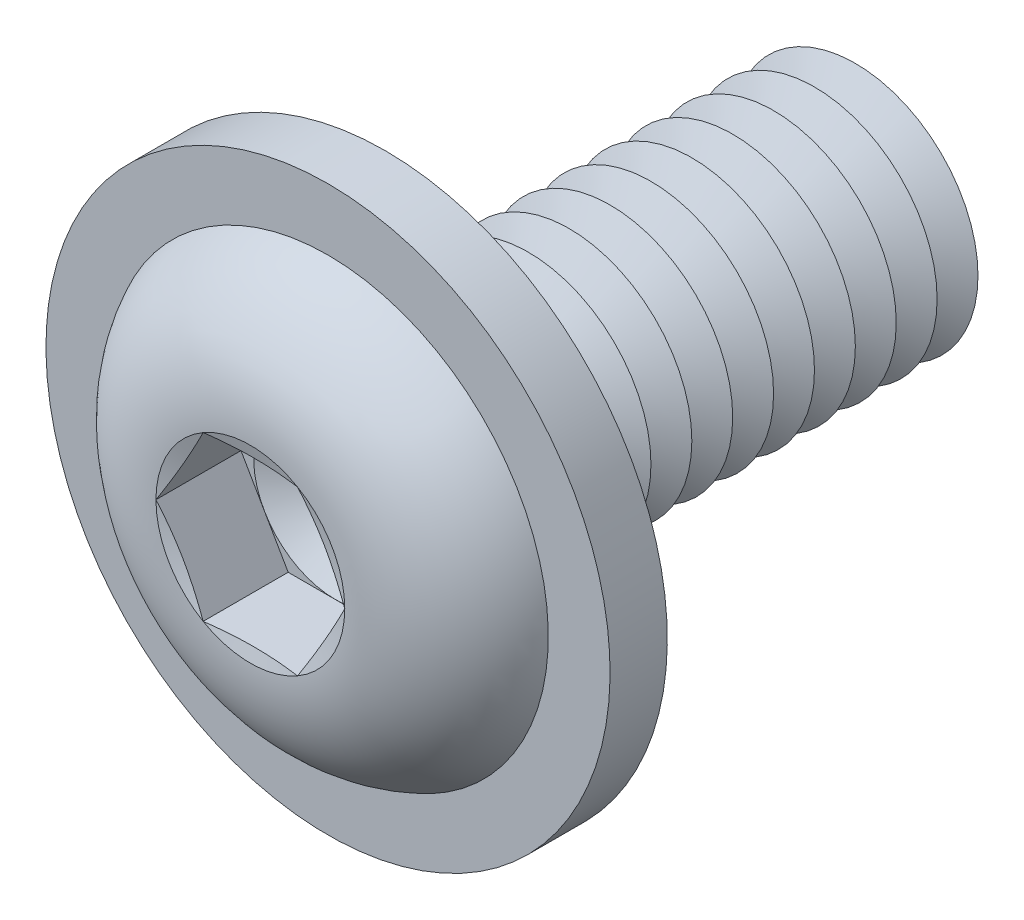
SolidWorks part; units mm, degrees
ref_plane "Front Plane" through (0, 0, 0) normal (0, 0, 1) x (1, 0, 0)
ref_plane "Top Plane" through (0, 0, 0) normal (0, 1, 0) x (1, 0, 0)
ref_plane "Right Plane" through (0, 0, 0) normal (1, 0, 0) x (0, 0, -1)
sketch "Sketch1" plane through (0, 0, 0) normal (1, 0, 0) x (0, 0, -1)
  line L0 (0, 1.5) -> (0, 2.85)
  line L3 (0, 1.5) -> (6, 1.5)
  line L4 (6, 1.5) -> (6, 0)
  line L5 (6, 0) -> (-1.65, 0) construction
  line L6 (-1.65, 0) -> (6, 0)
  line L7 (-1.65, 1.1547) -> (-1.65, 0.5773) construction
  line L8 (-1.65, 0.5773) -> (-1.65, 0)
  line L9 (-1.65, 1.1547) -> (-1.4953, 0.5773)
  line L10 (-1.4953, 0.5773) -> (-1.65, 0.5773)
  line L11 (6, 0) -> (22.7481, 0) construction
  line L12 (0, 2.85) -> (-1.65, 2.85) construction
  arc A1 (0, 2.85) -> (-1.65, 1.1547) centre (0, 1.1994) ccw
  point P8 (6, 0.75)
  dimension "D1" = 5.7
  dimension "D2" = 3
  dimension "D3" = 1.65
  dimension "D4" = 2.3094
  dimension "D5" = 6
  dimension "D6" = 15
revolve "Revolve1" add sketch "Sketch1" angle 360 about L5
fillet "Fillet1" radius 0.25 1 edges at (-1.5, 0, 0)
sketch "Sketch2" plane through (0, 0, 0) normal (1, 0, 0) x (0, 0, -1)
  line L0 (5.75, 1.5) -> (6.25, 1.5)
  line L1 (6, 1.5) -> (0.25, 1.5) construction
  line L2 (6.25, 1.5) -> (6, 1.067)
  line L3 (6, -1.5) -> (6, 1.5) construction
  line L4 (6, 1.067) -> (5.75, 1.5)
  dimension "D1" = 0.5
revolve "Cut-Revolve1" cut sketch "Sketch2" angle 360 about axis through (0, 0, -6) along (0, 0, -1)
pattern_linear "LPattern1" count 12 spacing 0.5 along (0, 0, 1) of "Cut-Revolve1"
sketch "Sketch3" plane through (0, 0, 1.65) normal (0, 0, 1) x (1, 0, 0)
  line L7 (0.5773, 1) -> (-0.5774, 1)
  line L8 (-0.5774, 1) -> (-1.1547, 0)
  line L9 (-1.1547, 0) -> (-0.5773, -1)
  line L10 (-0.5773, -1) -> (0.5773, -1)
  line L11 (0.5773, -1) -> (1.1547, 0)
  line L12 (1.1547, 0) -> (0.5773, 1)
  circle A0 centre (0, 0) radius 1 construction
  circle A3 centre (0, 0) radius 1.1547 construction
extrude "Cut-Extrude1" cut sketch "Sketch3" against normal blind 1.04
sketch "Sketch4" plane through (0, 0, 0.61) normal (0, 0, 1) x (1, 0, 0)
  line L1 (0.5773, 1) -> (-0.5774, 1) construction
  circle A0 centre (0, 0) radius 1
extrude "Cut-Extrude2" cut sketch "Sketch4" against normal through all draft 60
sketch "Sketch5" plane through (0, 0, 0) normal (0, 0, -1) x (-1, 0, 0)
  circle A0 centre (0, 0) radius 3.45
  circle A1 centre (0, 0) radius 1.75
  circle A2 centre (0, 0) radius 1.75 construction
  dimension "D1" = 6.9
extrude "Boss-Extrude1" add sketch "Sketch5" against normal blind 0.7
